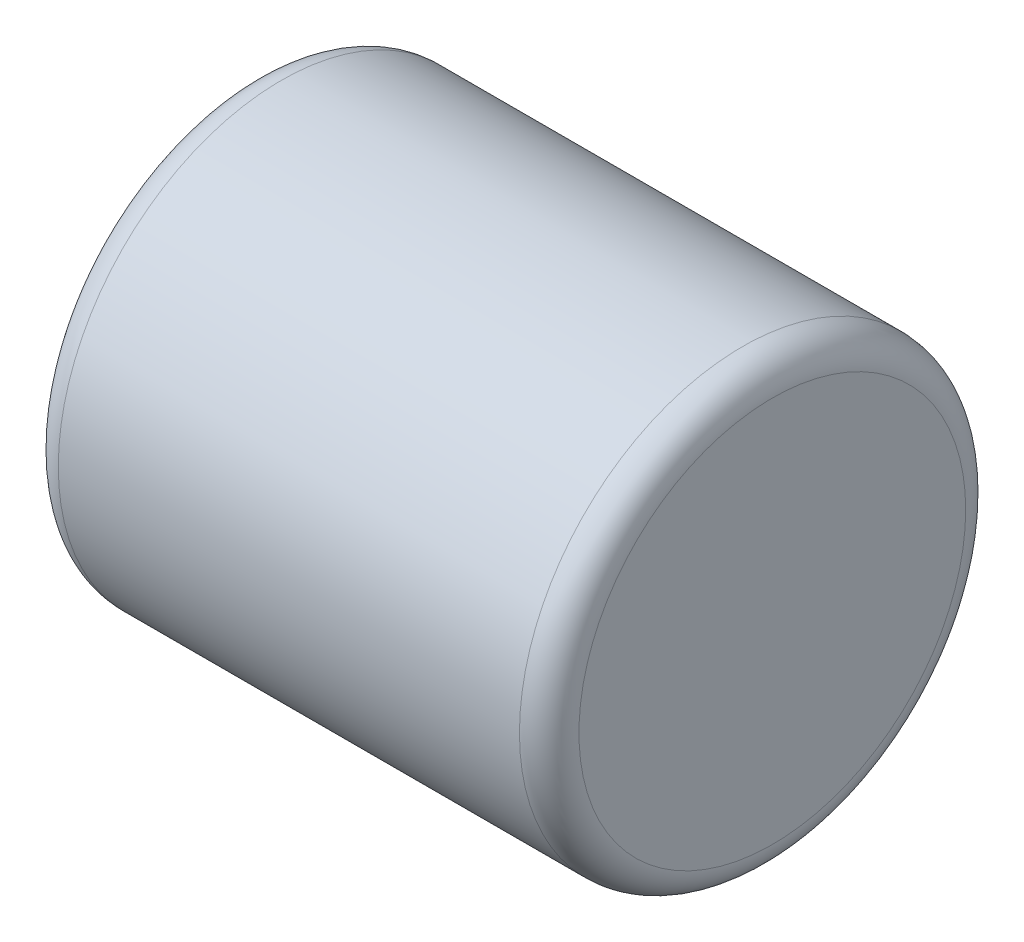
SolidWorks part; units mm, degrees
ref_plane "Plane1" through (0, 0, 0) normal (0, 0, 1) x (1, 0, 0)
ref_plane "Plane2" through (0, 0, 0) normal (0, 1, 0) x (1, 0, 0)
ref_plane "Plane3" through (0, 0, 0) normal (1, 0, 0) x (0, 0, -1)
sketch "Esquisse1" plane through (0, 0, 0) normal (0, 0, 1) x (1, 0, 0)
  line L0 (0, 0) -> (3.5, 0)
  line L1 (0, 0) -> (0, 1.5)
  line L2 (3.5, 1.5) -> (0, 1.5)
  line L3 (3.5, 1.5) -> (3.5, 0)
  line L4 (-2.5, 0) -> (6, 0) construction
revolve "Base-Révolution" add sketch "Esquisse1" angle 360 about L4
fillet "Congé1" radius 0.2
